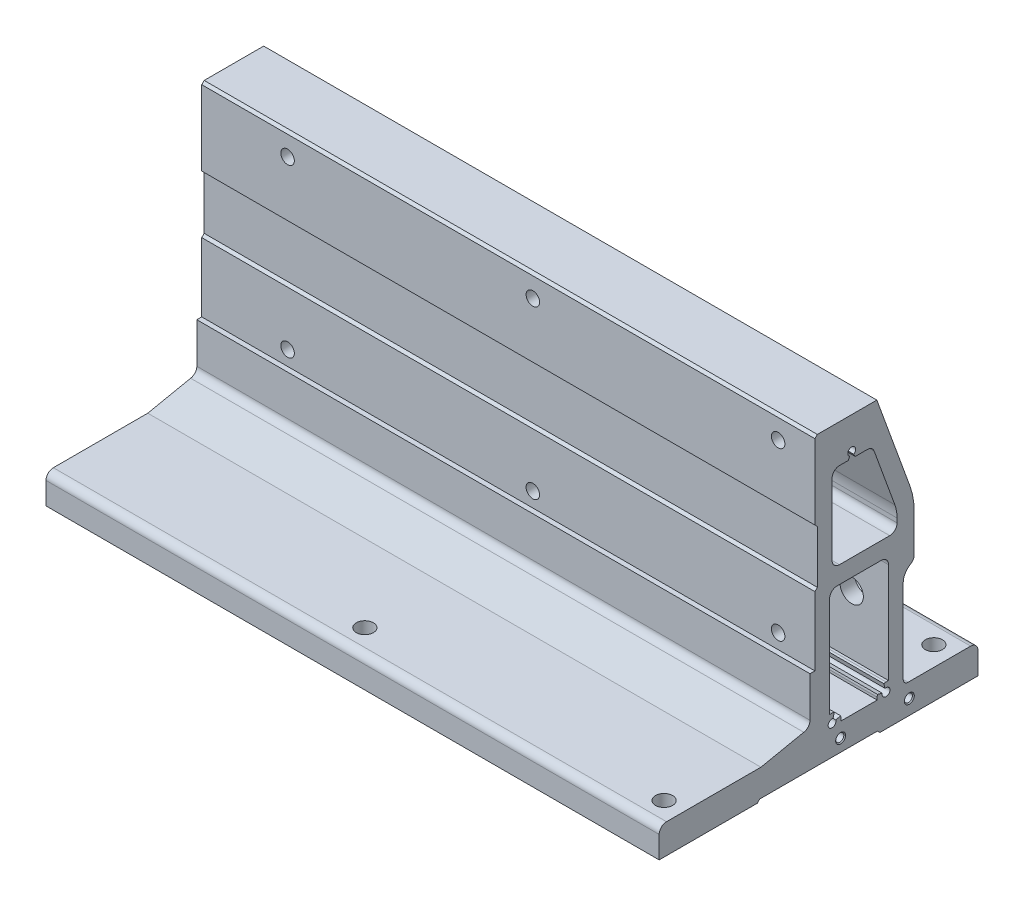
SolidWorks part; units mm, degrees
ref_plane "정면" through (0, 0, 0) normal (0, 0, 1) x (1, 0, 0)
ref_plane "윗면" through (0, 0, 0) normal (0, 1, 0) x (1, 0, 0)
ref_plane "우측면" through (0, 0, 0) normal (1, 0, 0) x (0, 0, -1)
sketch "스케치1" plane through (0, 0, 0) normal (1, 0, 0) x (0, 0, -1)
  line L0 (-1.5, 116) -> (-0.5, 117)
  line L1 (-0.5, 117) -> (23.7537, 117)
  line L2 (23.7537, 117) -> (37.1908, 80.0819)
  line L3 (39, 69.8213) -> (39, 54.7942)
  line L4 (34.5, 47) -> (34.5, 13)
  line L5 (36.5, 11) -> (62, 11)
  line L6 (65, 8) -> (65, -1)
  line L7 (65, -1) -> (25, -1)
  line L8 (25, -1) -> (24, 0)
  line L9 (24, 0) -> (-24, 0)
  line L10 (-24, 0) -> (-25, -1)
  line L11 (-25, -1) -> (-65, -1)
  line L12 (-65, -1) -> (-65, 8)
  line L13 (-62, 11) -> (-23.5, 11)
  line L14 (-23.5, 11) -> (-6.0351, 14.6023)
  line L15 (-3.5, 17.5661) -> (-3.5, 34)
  line L16 (-3.5, 34) -> (-1.5, 34)
  line L17 (-1.5, 34) -> (-1.5, 62)
  line L18 (-1.5, 62) -> (-0.5, 63)
  line L19 (-0.5, 63) -> (-0.5, 84.5)
  line L20 (-0.5, 84.5) -> (-1.5, 85.5)
  line L21 (-1.5, 85.5) -> (-1.5, 116)
  line L22 (22.6644, 99.5261) -> (31.0954, 76.3622)
  line L23 (32, 71.2319) -> (32, 69.5)
  line L24 (29, 66.5) -> (8.5, 66.5)
  line L25 (5.5, 69.5) -> (5.5, 98.5)
  line L26 (8.5, 101.5) -> (12.0566, 101.5)
  line L27 (12.0566, 101.5) -> (12.7, 102.6144)
  line L28 (14.3, 102.6144) -> (14.9434, 101.5)
  line L29 (14.9434, 101.5) -> (19.8454, 101.5)
  line L30 (28.5, 15.6) -> (28.5, 56.5)
  line L31 (25.5, 59.5) -> (7.5, 59.5)
  line L32 (4.5, 56.5) -> (4.5, 15.6)
  line L33 (4.5, 15.6) -> (5.5, 15.6)
  line L34 (6.4317, 15.4773) -> (5.9141, 13.5455)
  line L35 (7.0455, 12.4141) -> (8.9773, 12.9317)
  line L36 (9.1, 12) -> (9.1, 11)
  line L37 (9.1, 11) -> (23.9, 11)
  line L38 (23.9, 11) -> (23.9, 12)
  line L39 (24.0227, 12.9317) -> (25.9545, 12.4141)
  line L40 (27.0859, 13.5455) -> (26.5683, 15.4773)
  line L41 (27.5, 15.6) -> (28.5, 15.6)
  arc A0 (39, 69.8213) -> (37.1908, 80.0819) centre (9, 69.8213) ccw
  arc A1 (37.5, 52.1962) -> (39, 54.7942) centre (36, 54.7942) ccw
  arc A2 (37.5, 52.1962) -> (34.5, 47) centre (40.5, 47) ccw
  arc A3 (34.5, 13) -> (36.5, 11) centre (36.5, 13) ccw
  arc A4 (65, 8) -> (62, 11) centre (62, 8) ccw
  arc A5 (-62, 11) -> (-65, 8) centre (-62, 8) ccw
  arc A6 (-6.0351, 14.6023) -> (-3.5, 17.5661) centre (-6.5, 17.5661) ccw
  arc A7 (32, 71.2319) -> (31.0954, 76.3622) centre (17, 71.2319) ccw
  arc A8 (29, 66.5) -> (32, 69.5) centre (29, 69.5) ccw
  arc A9 (5.5, 69.5) -> (8.5, 66.5) centre (8.5, 69.5) ccw
  arc A10 (8.5, 101.5) -> (5.5, 98.5) centre (8.5, 98.5) ccw
  arc A11 (14.3, 102.6144) -> (12.7, 102.6144) centre (13.5, 104) ccw
  arc A12 (22.6644, 99.5261) -> (19.8454, 101.5) centre (19.8454, 98.5) ccw
  arc A13 (28.5, 56.5) -> (25.5, 59.5) centre (25.5, 56.5) ccw
  arc A14 (7.5, 59.5) -> (4.5, 56.5) centre (7.5, 56.5) ccw
  arc A15 (6.4317, 15.4773) -> (5.5, 15.6) centre (5.5, 12) ccw
  arc A16 (5.9141, 13.5455) -> (7.0455, 12.4141) centre (5.5, 12) ccw
  arc A17 (9.1, 12) -> (8.9773, 12.9317) centre (5.5, 12) ccw
  arc A18 (24.0227, 12.9317) -> (23.9, 12) centre (27.5, 12) ccw
  arc A19 (25.9545, 12.4141) -> (27.0859, 13.5455) centre (27.5, 12) ccw
  arc A20 (27.5, 15.6) -> (26.5683, 15.4773) centre (27.5, 12) ccw
extrude "보스-돌출1" add sketch "스케치1" along normal mid plane 250
hole_wizard "M5 소켓 머리 캡 나사용 카운터보어1" positions "스케치2" profile "스케치3" counterbore size "M5" standard "KS"
sketch "스케치2" plane through (0, 0, -39) normal (0, 0, -1) x (-1, 0, 0)
  line L0 (-125, 80.0819) -> (-125, 117) construction
  line L2 (-125, -1) -> (125, -1) construction
  point P0 (-110, 108)
  point P6 (-110, 40)
  dimension "D1" = 15
  dimension "D2" = 68
  dimension "D3" = 41
sketch "스케치3" plane through (110, 108, -39) normal (1, 0, 0) x (0, 1, 0)
  line L0 (0, 0) -> (0, 104)
  line L1 (0, 104) -> (2.75, 104)
  line L3 (2.75, 104) -> (2.75, 34.5)
  line L4 (2.75, 34.5) -> (4.75, 34.5)
  line L5 (4.75, 34.5) -> (4.75, 0)
  line L7 (4.75, 0) -> (0, 0)
  line L11 (0, -6.35) -> (0, 107.95) construction
  dimension "관통 구멍 지름" = 5.5
  dimension "관통 구멍 깊이" = 104
  dimension "카운터보어 지름" = 9.5
  dimension "카운터보어 깊이" = 34.5
hole_wizard "M4 나사 구멍1" positions "스케치4" profile "스케치5" tap size "M4" standard "ISO"
sketch "스케치4" plane through (125, 0, 0) normal (1, 0, 0) x (0, 0, -1)
  line L1 (65, -1) -> (65, 8) construction
  line L2 (25, -1) -> (65, -1) construction
  point P0 (37, 5)
  point P2 (9, 5)
  dimension "D1" = 28
  dimension "D2" = 28
  dimension "D3" = 6
sketch "스케치5" plane through (125, 5, -37) normal (0, 1, 0) x (0, 0, -1)
  line L0 (0, 0) -> (0, 10.9914)
  line L1 (0, 10.9914) -> (1.65, 10)
  line L2 (1.65, 10) -> (1.65, 0.375)
  line L3 (1.65, 0.375) -> (2.025, 0)
  line L5 (2.025, 0) -> (0, 0)
  line L6 (-1.65, 0.375) -> (-2.025, 0) construction
  line L10 (0, 10.9914) -> (-1.65, 10) construction
  line L11 (0, -6.35) -> (0, 107.95) construction
  dimension "탭 드릴 지름" = 3.3
  dimension "탭 드릴 깊이" = 10
  dimension "표면 카운터싱크 지름" = 4.05
  dimension "표면 카운터싱크 각도" = 90
  dimension "드릴 각도" = 118
hole_wizard "Ø5.0mm 맞춤핀 구멍1" positions "스케치6" profile "스케치7" hole size "Ø5.0" standard "ISO"
sketch "스케치6" plane through (0, 0, 0) normal (0, -1, 0) x (-1, 0, 0)
  line L0 (0, 0) -> (-157.7195, 0) construction
  line L1 (-125, -24) -> (-125, 24) construction
  point P6 (-117, 0)
  point P8 (5, 0)
  dimension "D1" = 122
  dimension "D2" = 8
sketch "스케치7" plane through (-5, 0, 0) normal (1, 0, 0) x (0, 0, -1)
  line L0 (0, 0) -> (0, 11.5022)
  line L1 (0, 11.5022) -> (2.5, 10)
  line L2 (2.5, 10) -> (2.5, 0)
  line L5 (2.5, 0) -> (0, 0)
  line L10 (0, 11.5022) -> (-2.5, 10) construction
  line L11 (0, -6.35) -> (0, 107.95) construction
  dimension "구멍 지름" = 5
  dimension "구멍 깊이" = 10
  dimension "드릴 각도" = 118
hole_wizard "Ø7.0 (7) 지름 구멍1" positions "스케치8" profile "스케치9" hole size "Ø7.0" standard "ISO"
sketch "스케치8" plane through (0, -1, 0) normal (0, -1, 0) x (-1, 0, 0)
  line L0 (-125, -65) -> (-125, -25) construction
  line L1 (-125, 65) -> (125, 65) construction
  point P0 (5, -55)
  point P2 (5, 55)
  point P4 (-117, 55)
  point P6 (-117, -55)
  dimension "D1" = 122
  dimension "D2" = 8
  dimension "D3" = 10
  dimension "D4" = 110
sketch "스케치9" plane through (-5, -1, 55) normal (1, 0, 0) x (0, 0, -1)
  line L0 (0, 0) -> (0, 118)
  line L1 (0, 118) -> (3.5, 118)
  line L2 (3.5, 118) -> (3.5, 0)
  line L5 (3.5, 0) -> (0, 0)
  line L11 (0, -6.35) -> (0, 107.95) construction
  dimension "관통 구멍 지름" = 7
  dimension "관통 구멍 깊이" = 118
pattern_linear "선형 패턴1" count 3 spacing 100 along (-1, 0, 0) of "M5 소켓 머리 캡 나사용 카운터보어1"
